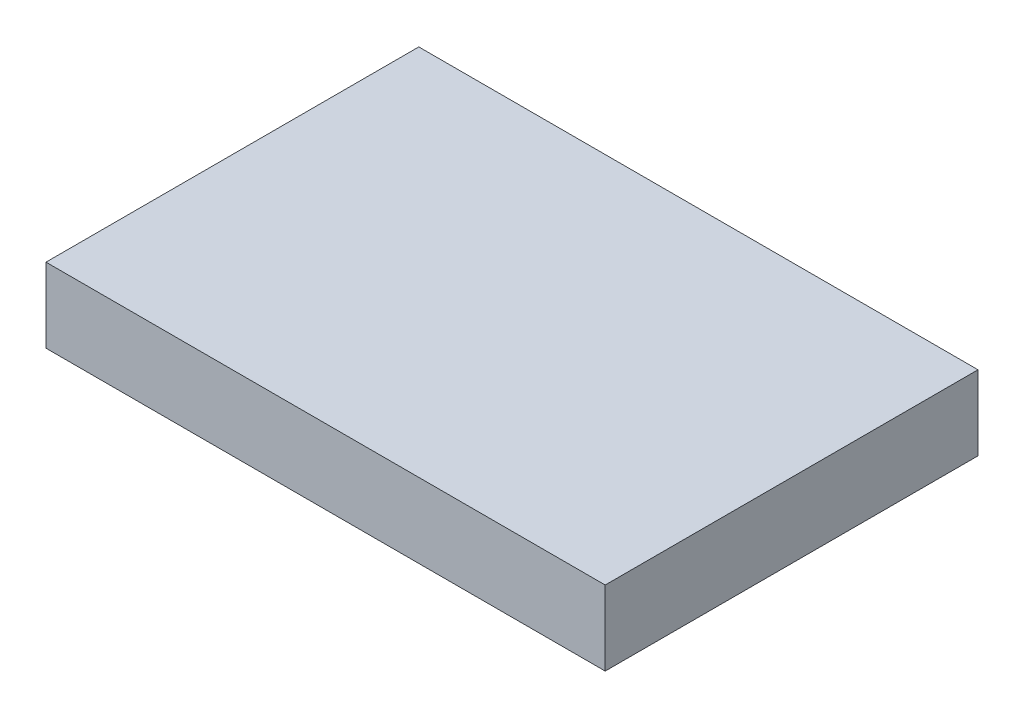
SolidWorks part; units mm, degrees
ref_plane "Front Plane" through (0, 0, 0) normal (0, 0, 1) x (1, 0, 0)
ref_plane "Top Plane" through (0, 0, 0) normal (0, 1, 0) x (1, 0, 0)
ref_plane "Right Plane" through (0, 0, 0) normal (1, 0, 0) x (0, 0, -1)
sketch "Sketch1" plane through (0, 0, 0) normal (0, 1, 0) x (1, 0, 0)
  line L0 (75, -50) -> (-75, 50) construction
  line L1 (-75, 50) -> (75, 50)
  line L2 (-75, 50) -> (-75, -50)
  line L3 (-75, -50) -> (75, -50)
  line L4 (75, 50) -> (75, -50)
  line L5 (-75, -50) -> (75, 50) construction
  point P4 (293.2771, 106.7487)
  point P5 (0, 0)
  dimension "D1" = 150
  dimension "D2" = 100
extrude "Boss-Extrude1" add sketch "Sketch1" along normal blind 20 contours L2 L3 L4 L1
sketch "Sketch2" plane through (0, 20, 0) normal (0, 1, 0) x (1, 0, 0)
  line L0 (-42, -50) -> (75, 24.4)
  line L3 (75, 50) -> (75, -50) construction
  line L4 (-75, -50) -> (75, -50) construction
  point P2 (75, 30.5503)
  point P5 (-39.1768, -50)
  dimension "D1" = 25.6
  dimension "D2" = 33
ref_plane "Plane1" through (75, 20, -24.4) normal (0.8438, 0, -0.5366) x (-0.5366, 0, -0.8438)
sketch "Sketch3" plane through (75, 20, -24.4) normal (0.8438, 0, -0.5366) x (-0.5366, 0, -0.8438)
  line L1 (11.15, 0) -> (-11.15, 0)
  line L2 (11.15, 0) -> (11.15, 20.05)
  line L3 (11.15, 20.05) -> (-11.15, 20.05)
  line L4 (-11.15, 0) -> (-11.15, 20.05)
  point P4 (19.3741, 39.6734)
  point P5 (0, 0)
  dimension "D1" = 20.05
  dimension "D2" = 22.3
